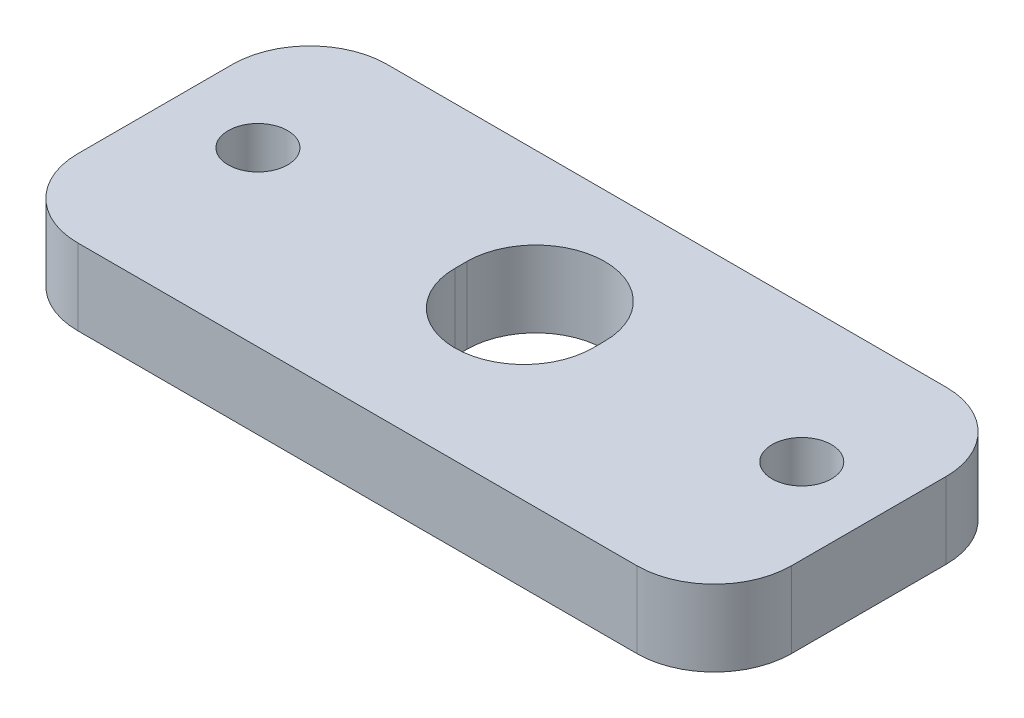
SolidWorks part; units mm, degrees
ref_plane "Front Plane" through (0, 0, 0) normal (0, 0, 1) x (1, 0, 0)
ref_plane "Top Plane" through (0, 0, 0) normal (0, 1, 0) x (1, 0, 0)
ref_plane "Right Plane" through (0, 0, 0) normal (1, 0, 0) x (0, 0, -1)
sketch "Sketch1" plane through (0, 0, 0) normal (0, 1, 0) x (1, 0, 0)
  line L0 (0, 6.25) -> (0, 0.75) construction
  line L1 (-14.75, 6.25) -> (14.75, 6.25)
  line L2 (-14.75, 6.25) -> (-14.75, -6.25)
  line L3 (-14.75, -6.25) -> (14.75, -6.25)
  line L4 (14.75, 6.25) -> (14.75, -6.25)
  line L5 (-11.43, 0.75) -> (11.43, 0.75) construction
  point P4 (-14.75, 0)
  point P6 (0, 6.25)
  dimension "D1" = 29.5
  dimension "D2" = 12.5
  dimension "D3" = 5.5
  dimension "D4" = 22.86
extrude "Boss-Extrude1" add sketch "Sketch1" along normal blind 3.2
hole_wizard "M5 Clearance Hole1" positions "Sketch2" profile "Sketch3" hole size "M5" standard "ANSI Metric"
sketch "Sketch2" plane through (0, 3.2, 0) normal (0, 1, 0) x (1, 0, 0)
  point P0 (0, 0.75)
sketch "Sketch3" plane through (0, 3.2, -0.75) normal (1, 0, 0) x (0, 0, 1)
  line L0 (0, 0) -> (0, 3.2)
  line L1 (0, 3.2) -> (2.9, 3.2)
  line L2 (2.9, 3.2) -> (2.9, 0)
  line L5 (2.9, 0) -> (0, 0)
  line L11 (0, -6.35) -> (0, 107.95) construction
  dimension "Thru Hole Dia." = 5.8
  dimension "Thru Hole Depth" = 3.2
sketch "Sketch4" plane through (0, 3.2, 0) normal (0, 1, 0) x (1, 0, 0)
  line L0 (0, 0.5) -> (0, 1) construction
  line L1 (0, 6.25) -> (0, 0.75) construction
  line L2 (-2.9, 0.5) -> (-2.9, 1)
  line L3 (2.9, 0.5) -> (2.9, 1)
  line L5 (0, -2.4) -> (0, 3.9) construction
  arc A0 (-2.9, 0.5) -> (2.9, 0.5) centre (0, 0.5) ccw
  arc A1 (2.9, 1) -> (-2.9, 1) centre (0, 1) ccw
  circle A2 centre (0, 0.75) radius 2.9 construction
  point P5 (0, 0.75)
  dimension "D1" = 0.25
  dimension "D2" = 6.3
extrude "Cut-Extrude1" cut sketch "Sketch4" against normal through all
sketch "Sketch5" plane through (0, 3.2, 0) normal (0, 1, 0) x (1, 0, 0)
  line L0 (15, 6.5) -> (-15, 6.5)
  line L1 (-15, 6.5) -> (-15, -6.5)
  line L2 (-15, -6.5) -> (15, -6.5)
  line L3 (15, -6.5) -> (15, 6.5)
  line L4 (-14.75, 6.25) -> (-14.75, -6.25)
  line L5 (-14.75, -6.25) -> (14.75, -6.25)
  line L6 (14.75, -6.25) -> (14.75, 6.25)
  line L7 (14.75, 6.25) -> (-14.75, 6.25)
  line L8 (-14.75, 6.25) -> (-14.75, -6.25)
  line L9 (-14.75, -6.25) -> (14.75, -6.25)
  line L10 (14.75, -6.25) -> (14.75, 6.25)
  line L11 (14.75, 6.25) -> (-14.75, 6.25)
  dimension "D1" = 0
  dimension "D2" = 0.25
extrude "Boss-Extrude2" add sketch "Sketch5" against normal up to surface (3.2 mm away)
fillet "Fillet1" radius 3.25 4 edges at (15, 1.6, -6.5) (-15, 1.6, -6.5) (-15, 1.6, 6.5) (15, 1.6, 6.5)
hole_wizard "M3x0.5 Tapped Hole1" positions "Sketch6" profile "Sketch7" tap size "M3x0.5" standard "ANSI Metric"
sketch "Sketch6" plane through (0, 3.2, 0) normal (0, 1, 0) x (1, 0, 0)
  point P2 (-11.43, 0.75)
  point P5 (11.43, 0.75)
sketch "Sketch7" plane through (-11.43, 3.2, -0.75) normal (1, 0, 0) x (0, 0, 1)
  line L0 (0, 0) -> (0, 3.2)
  line L1 (0, 3.2) -> (1.25, 3.2)
  line L2 (1.25, 3.2) -> (1.25, 0)
  line L5 (1.25, 0) -> (0, 0)
  line L11 (0, -6.35) -> (0, 107.95) construction
  dimension "Thru Tap Drill Dia." = 2.5
  dimension "Thru Tap Drill Depth" = 3.2
